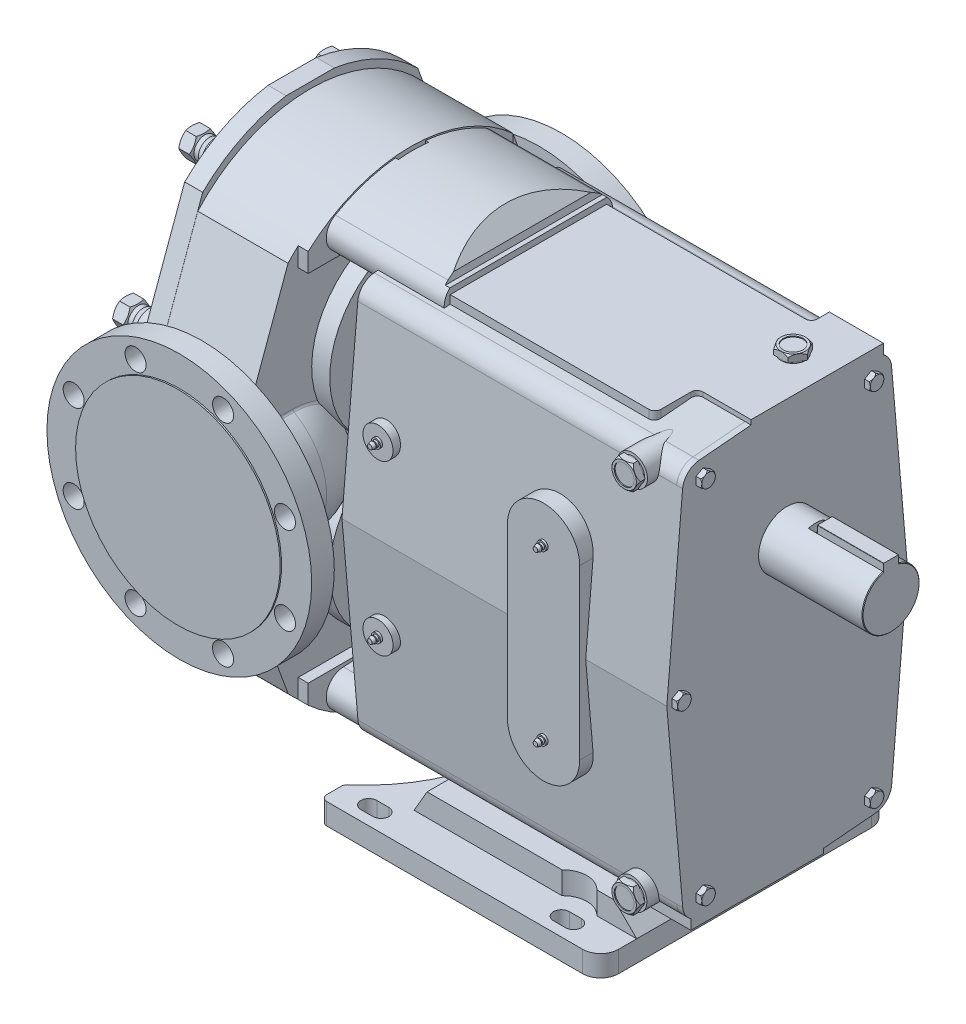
SolidWorks part; units mm, degrees
ref_plane "Front Plane" through (0, 0, 0) normal (0, 0, 1) x (1, 0, 0)
ref_plane "Top Plane" through (0, 0, 0) normal (0, 1, 0) x (1, 0, 0)
ref_plane "Right Plane" through (0, 0, 0) normal (1, 0, 0) x (0, 0, -1)
other "Join1"
other "grease fitting<4>@320_U2_Upper Shaft"
other "grease fitting<2>@320_U2_Upper Shaft"
other "cleanout plug<2>@320_U2_Upper Shaft"
other "oil plug<6>@320_U2_Upper Shaft"
other "oil plug<4>@320_U2_Upper Shaft"
other "108373<8>@320_U2_Upper Shaft"
other "108373<7>@320_U2_Upper Shaft"
other "108373<6>@320_U2_Upper Shaft"
other "108373<4>@320_U2_Upper Shaft"
other "108373<3>@320_U2_Upper Shaft"
other "108373<2>@320_U2_Upper Shaft"
other "Key_320<1>@320_U2_Upper Shaft"
other "Shaft_320 U2<1>@320_U2_Upper Shaft"
other "new cover_gearcase_40669<1>@320_U2_Upper Shaft"
other "grease fitting<3>@320_U2_Upper Shaft"
other "grease fitting<1>@320_U2_Upper Shaft"
other "cleanout plug<1>@320_U2_Upper Shaft"
other "oil plug<5>@320_U2_Upper Shaft"
other "oil plug<3>@320_U2_Upper Shaft"
other "oil plug<2>@320_U2_Upper Shaft"
other "oil plug<1>@320_U2_Upper Shaft"
other "108373<5>@320_U2_Upper Shaft"
other "108373<1>@320_U2_Upper Shaft"
other "105406<1>@320_U2_Upper Shaft"
other "109968<1>@320_U2_Upper Shaft"
other "40288<1>@320_U2_Upper Shaft"
other "105478<1>@320_U2_Upper Shaft"
other "body_shim-210-320-370U2<2>@320_U2_Upper Shaft"
other "body_shim-210-320-370U2<1>@320_U2_Upper Shaft"
